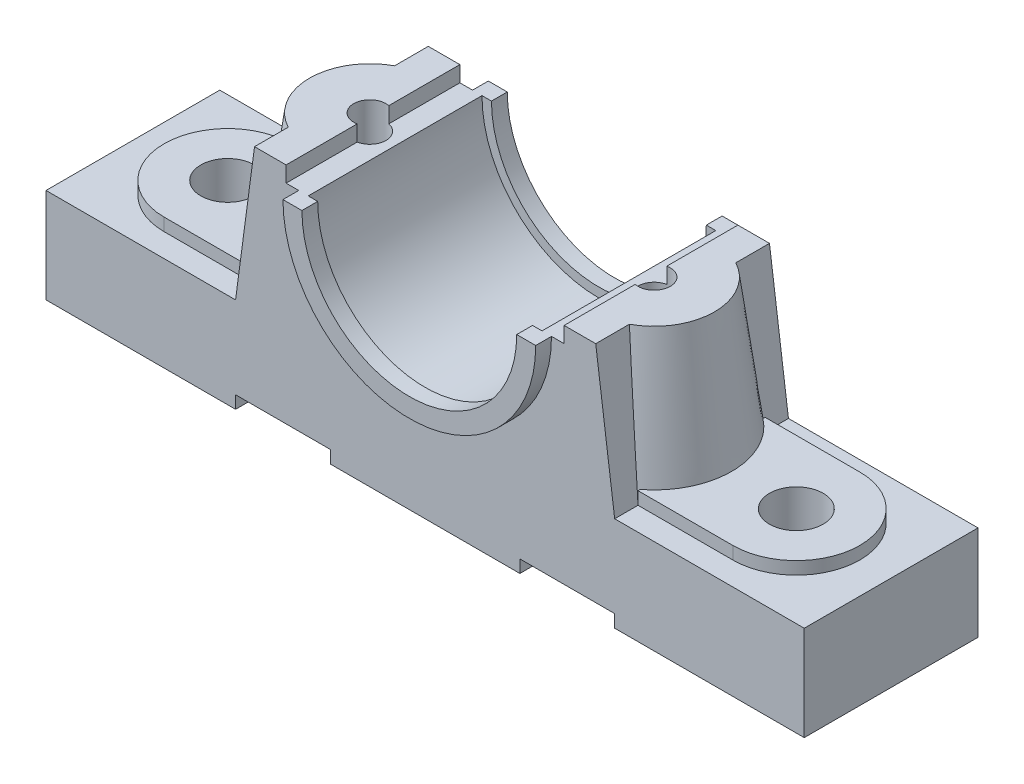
SolidWorks part; units mm, degrees
ref_plane "前视基准面" through (0, 0, 0) normal (0, 0, 1) x (1, 0, 0)
ref_plane "上视基准面" through (0, 0, 0) normal (0, 1, 0) x (1, 0, 0)
ref_plane "右视基准面" through (0, 0, 0) normal (1, 0, 0) x (0, 0, -1)
sketch "草图1" plane through (0, 0, 0) normal (0, 0, 1) x (1, 0, 0)
  line L0 (0, 125.4891) -> (0, -88.5168) construction
  line L1 (0, 0) -> (-30, 0)
  line L2 (-30, 0) -> (-30, 4)
  line L3 (-30, 4) -> (-60, 4)
  line L4 (-60, 4) -> (-60, 0)
  line L5 (-60, 0) -> (-120, 0)
  line L6 (-120, 0) -> (-120, 30)
  line L7 (-120, 30) -> (-60, 30)
  line L8 (-60, 30) -> (-54, 75)
  line L9 (-54, 75) -> (0, 75)
  line L10 (0, 75) -> (0, 0)
  dimension "D1" = 120
  dimension "D2" = 60
  dimension "D3" = 30
  dimension "D4" = 4
  dimension "D5" = 30
  dimension "D6" = 60
  dimension "D7" = 54
  dimension "D8" = 75
extrude "拉伸1" add sketch "草图1" along normal mid plane 55
sketch "草图2" plane through (0, 0, 0) normal (0, 0, 1) x (1, 0, 0)
  line L0 (-45, -39.8946) -> (-45, 122.5575) construction
  line L1 (-45, 30) -> (-70.0885, 30)
  line L2 (-60, 30) -> (-120, 30) construction
  line L3 (-70.0885, 30) -> (-64.0885, 75)
  line L4 (-64.0885, 75) -> (-45, 75)
  line L5 (0, 75) -> (-54, 75) construction
  line L6 (-45, 75) -> (-45, 30)
  line L7 (-54, 75) -> (-60, 30) construction
  dimension "D1" = 10
revolve "旋转1" add sketch "草图2" angle 360 about L0
sketch "草图3" plane through (0, 30, 0) normal (0, 1, 0) x (1, 0, 0)
  line L0 (-60, 20.1105) -> (-90, 20.1105)
  line L1 (-90, -20.1105) -> (-60, -20.1105)
  line L2 (-60, 20.1105) -> (-60, -20.1105)
  arc A0 (-90, 20.1105) -> (-90, -20.1105) centre (-90, 0) ccw
  dimension "D1" = 90
extrude "拉伸2" add sketch "草图3" along normal blind 4
sketch "草图4" plane through (0, 34, 0) normal (0, 1, 0) x (1, 0, 0)
  circle A0 centre (-90, 0) radius 8.5
  dimension "D1" = 17
extrude "切除-拉伸1" cut sketch "草图4" against normal through all
sketch "草图5" plane through (0, 0, 0) normal (0, 0, 1) x (1, 0, 0)
  line L0 (0, 0) -> (0, 75) construction
  line L1 (0, 70) -> (-44, 70) construction
  line L2 (-40, 70) -> (-44, 70)
  line L3 (-44, 70) -> (-44, 75)
  line L4 (0, 75) -> (-54, 75) construction
  line L5 (0, 75) -> (0, 30)
  line L6 (0, 75) -> (-44, 75)
  arc A0 (-40, 70) -> (0, 30) centre (0, 70) ccw
  dimension "D2" = 80
  dimension "D1" = 70
  dimension "D3" = 10
extrude "切除-拉伸2" cut sketch "草图5" against normal mid plane 55
sketch "草图6" plane through (0, 0, 0) normal (0, 0, 1) x (1, 0, 0)
  line L0 (-40, 70) -> (-34, 70)
  line L1 (0, 30) -> (0, 36)
  arc A0 (-34, 70) -> (0, 36) centre (0, 70) ccw
  arc A1 (-40, 70) -> (0, 30) centre (0, 70) ccw construction
  arc A2 (-40, 70) -> (0, 30) centre (0, 70) ccw
  dimension "D1" = 68
extrude "拉伸3" add sketch "草图6" along normal mid plane 65
sketch "草图7" plane through (0, 0, 0) normal (0, 0, 1) x (1, 0, 0)
  line L1 (-37, 70) -> (-34, 70)
  line L2 (0, 36) -> (0, 33)
  arc A0 (-37, 70) -> (0, 33) centre (0, 70) ccw
  arc A1 (-34, 70) -> (0, 36) centre (0, 70) ccw construction
  arc A2 (-34, 70) -> (0, 36) centre (0, 70) ccw
  dimension "D1" = 74
extrude "切除-拉伸3" cut sketch "草图7" against normal mid plane 55
hole_wizard "M12 螺纹孔1" positions "草图10" profile "草图9" tap size "M12" standard "ISO"
sketch "草图10" plane through (0, 75, 0) normal (0, 1, 0) x (-1, 0, 0)
  point P1 (45, 0)
sketch "草图9" plane through (-45, 75, 0) normal (1, 0, 0) x (0, 0, 1)
  line L0 (0, 0) -> (0, 75)
  line L1 (0, 75) -> (5.1, 75)
  line L2 (5.1, 75) -> (5.1, 0)
  line L5 (5.1, 0) -> (0, 0)
  line L11 (0, -6.35) -> (0, 107.95) construction
  dimension "籵謂蹟恇謂郰芛眻噤" = 10.2
  dimension "籵謂蹟恇謂郰芛旮僅" = 75
sketch "草图12" plane through (0, 0, 0) normal (0, 0, 1) x (1, 0, 0)
  line L0 (-60, 0) -> (-60, 15)
  line L1 (-60, 15) -> (-30, 15)
  line L2 (-30, 15) -> (-30, 0)
  line L3 (-30, 0) -> (-60, 0)
  dimension "D1" = 15
extrude "切除-拉伸4" cut sketch "草图12" against normal mid plane 30
mirror "镜向3" about plane through (0, 75, 27.5) normal (-1, 0, 0)
